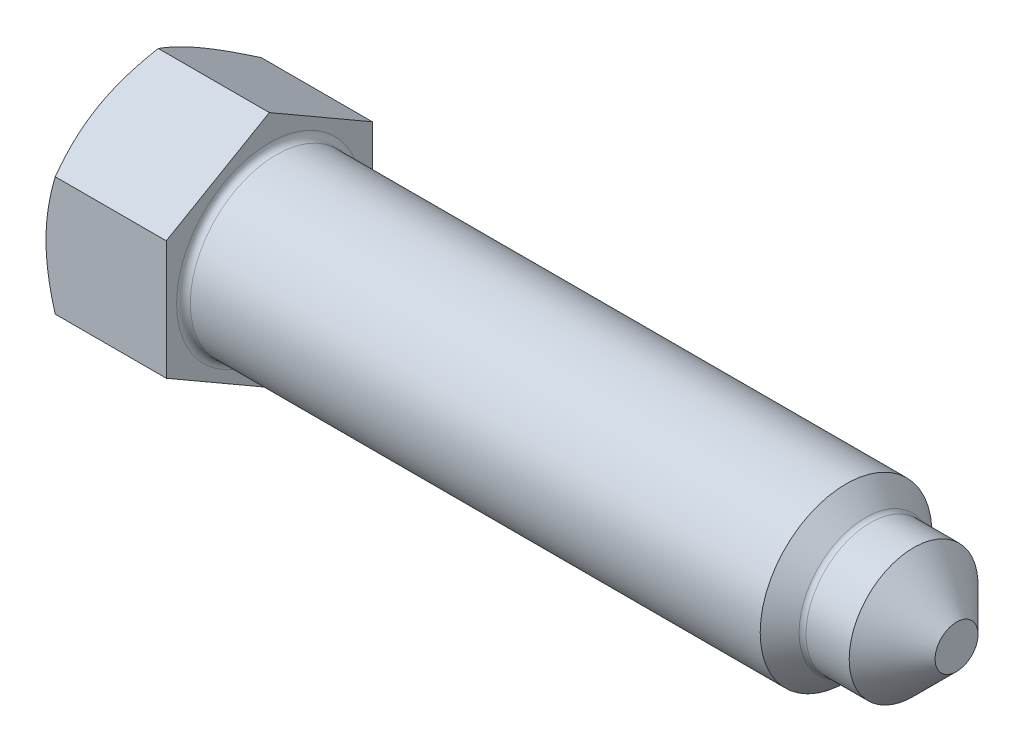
SolidWorks part; units mm, degrees
ref_plane "Plane1" through (0, 0, 0) normal (0, 0, 1) x (1, 0, 0)
ref_plane "Plane2" through (0, 0, 0) normal (0, 1, 0) x (1, 0, 0)
ref_plane "Plane3" through (0, 0, 0) normal (1, 0, 0) x (0, 0, -1)
sketch "HexSke" plane through (0, 0, 0) normal (1, 0, 0) x (0, 0, -1)
  line L0 (12, 6.9282) -> (12, -6.9282)
  line L1 (-12, 6.9282) -> (-12, -6.9282)
  line L2 (12, -6.9282) -> (0, -13.8564)
  line L3 (0, -13.8564) -> (-12, -6.9282)
  line L4 (12, 6.9282) -> (0, 13.8564)
  line L5 (0, 13.8564) -> (-12, 6.9282)
  dimension "Width_flats" = 24
  dimension "D2" = 120
  dimension "D3" = 12
  dimension "D4" = 12
  dimension "D5" = 12
extrude "BaseHead" add sketch "HexSke" along normal blind 14
sketch "BodySke" plane through (0, 0, 0) normal (0, 0, 1) x (1, 0, 0)
  line L0 (0, 6.9282) -> (0, -6.9282) construction
  line L1 (0, 0) -> (94, 0)
  line L2 (0, 0) -> (0, 10)
  line L3 (0, 10) -> (81.14, 10)
  line L4 (94, 0) -> (94, 2.5)
  line L5 (14, 13.8564) -> (14, 6.9282) construction
  line L6 (83.64, 7.5) -> (81.14, 10)
  line L7 (0, 0) -> (105.7297, 0) construction
  line L8 (40.0661, 17) -> (115.5134, 17) construction
  line L9 (0, -10) -> (81.14, -10) construction
  line L10 (16.5, 15.24) -> (16.5, -1.27) construction
  line L11 (89, 7.5) -> (83.64, 7.5)
  line L12 (14, 6.9282) -> (14, -6.9282) construction
  line L13 (89, 7.5) -> (94, 2.5)
  dimension "Length" = 80
  dimension "Body_ch_ang" = 45
  dimension "Diameter" = 20
  dimension "Minor_dia" = 17
  dimension "Advance" = 2.5
  dimension "Dog_Lg" = 10.36
  dimension "Cone_lg" = 5
  dimension "Dog_dia" = 15
revolve "BaseBody" add sketch "BodySke" angle 360 about L7
sketch "Sketch3" plane through (0, 0, 0) normal (0, 0, 1) x (1, 0, 0)
  line L0 (0, 12) -> (3.9585, 18.8564)
  line L1 (0, 13.8564) -> (0, 6.9282) construction
  line L2 (3.9585, 18.8564) -> (3.9585, 23.8564)
  line L3 (3.9585, 23.8564) -> (-10, 23.8564)
  line L4 (-10, 23.8564) -> (-10, 12)
  line L5 (-10, 12) -> (0, 12)
  line L6 (0, 0) -> (99.06, 0) construction
  line L7 (14, 13.8564) -> (0, 13.8564) construction
  dimension "D1" = 12
  dimension "D2" = 5
  dimension "D3" = 10
  dimension "D4" = 5
  dimension "Head_ch_ang" = 30
revolve "HeadChamfer" cut sketch "Sketch3" angle 360 about L6
fillet "HeadFillet" radius 0.8 1 edges at (14, 0, -10)
fillet "PointFillet" radius 0.8 1 edges at (83.64, 0, 7.5)
sketch "ThdSchSke" plane through (0, 0, 0) normal (0, 0, 1) x (1, 0, 0)
  line L0 (16.16, -8.5) -> (15.1097, -10)
  line L1 (16.16, -8.5) -> (17.2103, -10)
  line L2 (17.2103, -10) -> (17.2103, -12.5)
  line L3 (-3.175, 0) -> (5.1513, 0) construction
  line L5 (17.2103, -12.5) -> (15.1097, -12.5)
  line L6 (15.1097, -12.5) -> (15.1097, -10)
  dimension "Thread_minor" = 17
  dimension "Diameter" = 20
  dimension "Start" = 16.16
  dimension "SideAngle" = 55
  dimension "VeeAngle" = 70
  dimension "Overcut" = 25
revolve "ThreadSchematic" [suppressed] cut sketch "ThdSchSke" angle 360 about L3
pattern_linear "ThdSchPat" [suppressed]
equation "\"D3@HexSke\" = \"Width_flats@HexSke\" / 2"
equation "\"D4@HexSke\" = \"D3@HexSke\""
equation "\"D5@HexSke\" = \"D4@HexSke\""
equation "\"Thread_minor@ThreadCosmetic\" = \"Minor_dia@BodySke\""
equation "\"D1@Sketch3\" = \"Width_flats@HexSke\" / 2"
equation "\"Thread_length@ThreadCosmetic\" = \"Length@BodySke\" - \"Dog_lg@BodySke\" - \"Advance@BodySke\""
equation "\"Thread_minor@ThdSchSke\" = \"Minor_dia@BodySke\""
equation "\"Diameter@ThdSchSke\" = \"Diameter@BodySke\""
equation "\"Overcut@ThdSchSke\" = \"Diameter@BodySke\" * 1.25"
equation "\"Start@ThdSchSke\" = \"Fillet_Radius@HeadFillet\" + \"Advance@BodySke\" + \"Length@BodySke\" - \"Thread_length@ThreadCosmetic\""
equation "\"Num_threads@ThdSchPat\" = int( \"Thread_length@ThreadCosmetic\" / \"Advance@BodySke\" + 0.999 )  + 1"
equation "\"Advance@ThdSchPat\" = \"Thread_length@ThreadCosmetic\" /  (\"Num_threads@ThdSchPat\" - 1) 'relax it"
equation "\"Num_threads@ThdSchPat\" = \"Num_threads@ThdSchPat\" - sgn( \"Num_threads@ThdSchPat\" - 1) '---chamfered tips only---"
equation "\"Fillet_radius@PointFillet\" = \"Fillet_radius@HeadFillet\""
